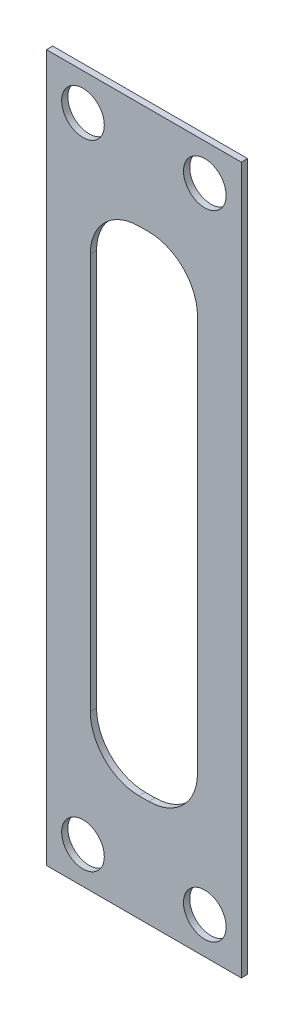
SolidWorks part; units mm, degrees
ref_plane "Front" through (0, 0, 0) normal (0, 0, 1) x (1, 0, 0)
ref_plane "Top" through (0, 0, 0) normal (0, 1, 0) x (1, 0, 0)
ref_plane "Right" through (0, 0, 0) normal (1, 0, 0) x (0, 0, -1)
sketch "Sketch1" plane through (0, 0, 0) normal (0, 0, 1) x (1, 0, 0)
  line L0 (0, 0) -> (-6.985, 0) construction
  line L1 (-12.7, 46.0375) -> (12.7, 46.0375)
  line L2 (-12.7, 46.0375) -> (-12.7, -46.0375)
  line L3 (-12.7, -46.0375) -> (12.7, -46.0375)
  line L4 (12.7, 46.0375) -> (12.7, -46.0375)
  line L5 (-0.635, 32.1437) -> (0.635, 32.1437)
  line L6 (-6.985, 25.7937) -> (-6.985, -25.7937)
  line L8 (6.985, 25.7937) -> (6.985, -25.7937)
  line L9 (-0.635, -32.1437) -> (0.635, -32.1437)
  arc A0 (-6.985, 25.7937) -> (-0.635, 32.1437) centre (-0.635, 25.7937) cw
  arc A1 (6.985, 25.7937) -> (0.635, 32.1437) centre (0.635, 25.7937) ccw
  arc A2 (0.635, -32.1437) -> (6.985, -25.7937) centre (0.635, -25.7937) ccw
  arc A3 (-6.985, -25.7937) -> (-0.635, -32.1437) centre (-0.635, -25.7937) ccw
  point P19 (6.985, -32.1437)
  dimension "D7" = 64.2874
  dimension "D6" = 6.35
  dimension "D1" = 25.4
  dimension "D2" = 92.075
  dimension "D3" = 46.0375
  dimension "D4" = 12.7
  dimension "D5" = 13.97
  dimension "D8" = 6.985
extrude "Extrude1" add sketch "Sketch1" along normal mid plane 0.8128
hole_wizard "7/32 (0.21875) Diameter Hole1" positions "Sketch3" profile "Sketch2" hole size "7/32" standard "Ansi Inch"
sketch "Sketch3" plane through (0, 0, 0.4064) normal (0, 0, 1) x (1, 0, 0)
  point P0 (-7.9375, 41.275)
  point P1 (7.9375, 41.275)
  point P3 (7.9375, -41.275)
  point P5 (-7.9375, -41.275)
  dimension "D1" = 82.55
  dimension "D2" = 15.875
  dimension "D3" = 7.9375
  dimension "D4" = 41.275
sketch "Sketch2" plane through (-7.9375, 41.275, 0.4064) normal (1, 0, 0) x (0, -1, 0)
  line L0 (0, 0) -> (0, 0.8128)
  line L1 (0, 0.8128) -> (2.7781, 0.8128)
  line L2 (2.7781, 0.8128) -> (2.7781, 0)
  line L5 (2.7781, 0) -> (0, 0)
  line L11 (0, -6.35) -> (0, 107.95) construction
  dimension "Thru Hole Dia." = 5.5562
  dimension "Thru Hole Depth" = 0.8128
equation "\"D3@Sketch1\" = \"D2@Sketch1\"/2"
equation "\"D4@Sketch1\" = \"D1@Sketch1\"/2"
equation "\"D8@Sketch1\" = \"D5@Sketch1\"/2"
equation "\"D3@Sketch3\" = \"D2@Sketch3\"/2"
equation "\"D4@Sketch3\" = \"D1@Sketch3\"/2"
